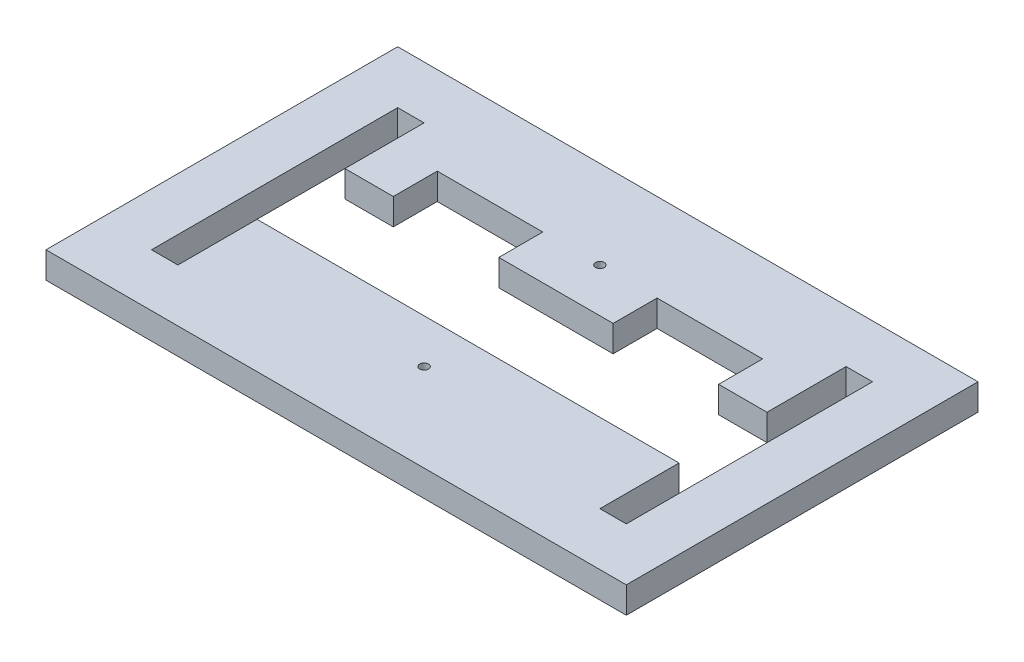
SolidWorks part; units mm, degrees
ref_plane "Front Plane" through (0, 0, 0) normal (0, 0, 1) x (1, 0, 0)
ref_plane "Top Plane" through (0, 0, 0) normal (0, 1, 0) x (1, 0, 0)
ref_plane "Right Plane" through (0, 0, 0) normal (1, 0, 0) x (0, 0, -1)
sketch "Sketch1" plane through (0, 0, 0) normal (0, 1, 0) x (1, 0, 0)
  line L1 (-33, 20) -> (33, 20)
  line L2 (-33, 20) -> (-33, -20)
  line L3 (-33, -20) -> (33, -20)
  line L4 (33, 20) -> (33, -20)
  line L5 (-33, 20) -> (33, -20) construction
  line L6 (-33, -20) -> (33, 20) construction
  point P0 (0, 0)
  dimension "D1" = 66
  dimension "D2" = 40
extrude "Boss-Extrude1" add sketch "Sketch1" along normal blind 3
sketch "Sketch2" plane through (0, 0, 0) normal (0, 1, 0) x (1, 0, 0)
  line L0 (0, 0) -> (0, 7.1838) construction
  line L1 (0, 0) -> (-25.5, 0) construction
  line L2 (33, 20) -> (-33, 20) construction
  line L3 (-24, -14) -> (-27, -14)
  line L4 (-24, -14) -> (-24, 14)
  line L5 (-24, 14) -> (-27, 14)
  line L6 (-27, -14) -> (-27, 14)
  line L7 (-24, -14) -> (-27, 14) construction
  line L8 (-24, 14) -> (-27, -14) construction
  line L9 (-33, 20) -> (-33, -20) construction
  line L10 (24, 14) -> (27, -14) construction
  line L11 (24, -14) -> (27, 14) construction
  line L12 (27, -14) -> (27, 14)
  line L13 (24, 14) -> (27, 14)
  line L14 (24, -14) -> (24, 14)
  line L15 (24, -14) -> (27, -14)
  line L16 (-13, -5) -> (-13, 5) construction
  line L17 (-20.5, -5) -> (-20.5, 5) construction
  line L18 (-5.5, -5) -> (-5.5, 5) construction
  line L19 (13, -5) -> (13, 5) construction
  line L20 (20.5, -5) -> (20.5, 5) construction
  line L21 (5.5, -5) -> (5.5, 5) construction
  circle A0 centre (0, 0) radius 1.75
  arc A1 (-20.5, -5) -> (-5.5, -5) centre (-13, -5) ccw construction
  arc A2 (-5.5, 5) -> (-20.5, 5) centre (-13, 5) ccw construction
  arc A3 (20.5, -5) -> (5.5, -5) centre (13, -5) cw construction
  arc A4 (5.5, 5) -> (20.5, 5) centre (13, 5) cw construction
  point P19 (-13, 0)
  point P26 (13, 0)
  dimension "D4" = 3.5
  dimension "D1" = 6
  dimension "D2" = 6
  dimension "D3" = 3
  dimension "D5" = 15
  dimension "D6" = 10
  dimension "D7" = 13
extrude "Cut-Extrude1" cut sketch "Sketch2" along normal up to next
sketch "Sketch3" plane through (0, 0, 0) normal (0, 1, 0) x (1, 0, 0)
  line L0 (24, 14) -> (24, -14) construction
  line L1 (-24, 5) -> (24, 5)
  line L2 (-24, 5) -> (-24, -5)
  line L3 (-24, -5) -> (24, -5)
  line L4 (24, 5) -> (24, -5)
  line L5 (-24, 5) -> (24, -5) construction
  line L6 (-24, -5) -> (24, 5) construction
  point P0 (0, 0)
  dimension "D1" = 10
extrude "Cut-Extrude2" cut sketch "Sketch3" along normal blind 10
sketch "Sketch4" plane through (0, 0, 0) normal (0, 1, 0) x (1, 0, 0)
  line L0 (0, 0) -> (0, 10) construction
  line L1 (0, 0) -> (-3.0302, 0) construction
  line L2 (-24, 5) -> (24, 5) construction
  line L3 (-18.5, 5) -> (-6.5, 5)
  line L4 (-18.5, 5) -> (-18.5, 10)
  line L5 (-18.5, 10) -> (-6.5, 10)
  line L6 (-6.5, 5) -> (-6.5, 10)
  line L7 (6.5, 5) -> (6.5, 10)
  line L8 (18.5, 10) -> (6.5, 10)
  line L9 (18.5, 5) -> (18.5, 10)
  line L11 (18.5, 5) -> (6.5, 5)
  circle A0 centre (0, 10) radius 0.5
  circle A1 centre (0, -10) radius 0.5
  point P17 (12.5, 10)
  point P19 (-12.5, 10)
  dimension "D1" = 1
  dimension "D2" = 10
  dimension "D3" = 12
  dimension "D4" = 5
  dimension "D5" = 6.5
extrude "Cut-Extrude3" cut sketch "Sketch4" along normal blind 10
